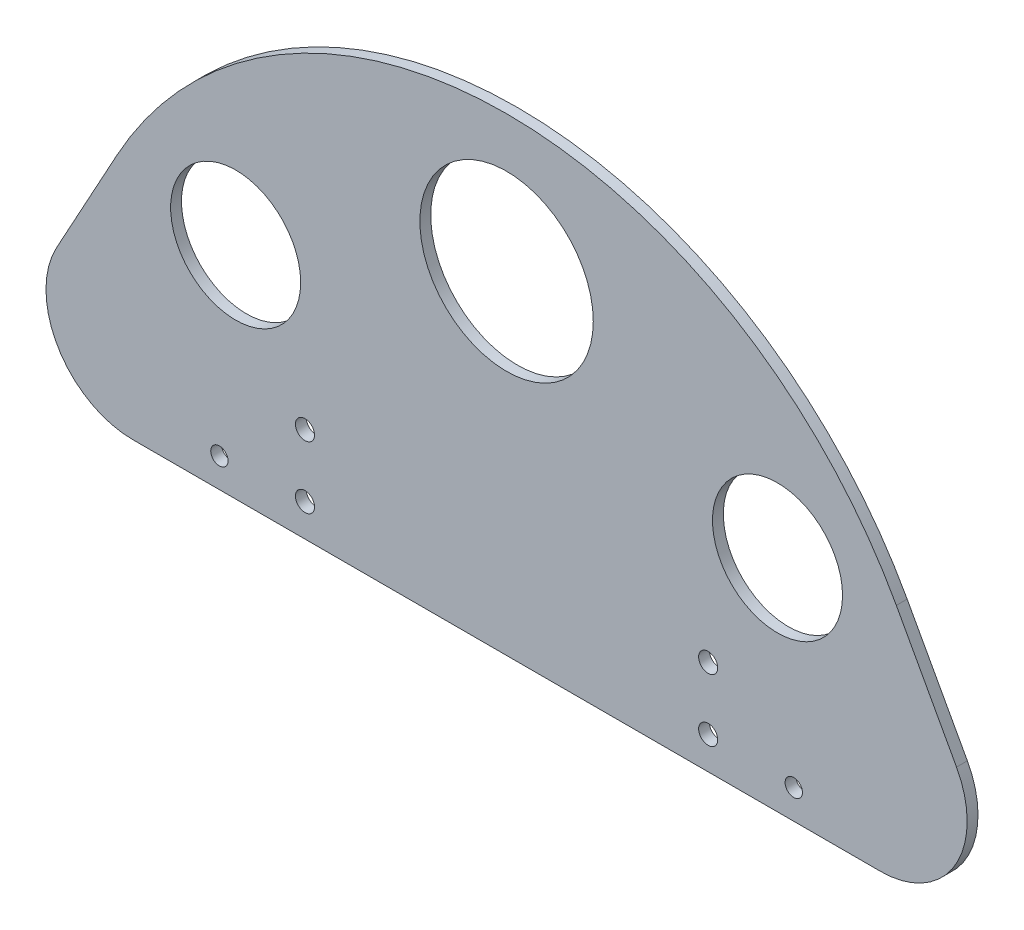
SolidWorks part; units mm, degrees
ref_plane "Front Plane" through (0, 0, 0) normal (0, 0, 1) x (1, 0, 0)
ref_plane "Top Plane" through (0, 0, 0) normal (0, 1, 0) x (1, 0, 0)
ref_plane "Right Plane" through (0, 0, 0) normal (1, 0, 0) x (0, 0, -1)
sketch "Sketch1" plane through (0, 0, 0) normal (0, 0, 1) x (1, 0, 0)
  line L0 (-219.075, -131.4329) -> (219.075, -131.4329)
  line L1 (263.6346, -56.2386) -> (228.3679, 8.1809)
  line L2 (-263.6346, -56.2386) -> (-228.3679, 8.1809)
  circle A0 centre (-158.75, -2.54) radius 38.1
  circle A1 centre (0, 63.5) radius 50.8
  arc A2 (219.075, -131.4329) -> (263.6346, -56.2386) centre (219.075, -80.6329) ccw
  circle A3 centre (158.75, -2.54) radius 38.1
  arc A4 (228.3679, 8.1809) -> (-228.3679, 8.1809) centre (0, -116.84) ccw
  arc A5 (-263.6346, -56.2386) -> (-219.075, -131.4329) centre (-219.075, -80.6329) ccw
  circle A6 centre (-118.11, -75.8831) radius 5.588
  circle A7 centre (-118.11, -112.3829) radius 5.588
  circle A8 centre (118.11, -75.8831) radius 5.588
  circle A9 centre (118.11, -112.3829) radius 5.588
  point P14 (304.8, -131.4329)
  point P15 (304.8, -131.4329)
  point P16 (304.8, -131.4329)
  point P18 (-304.8, -131.4329)
  point P24 (-304.8, -131.4329)
  dimension "D4" = 76.2
  dimension "D7" = 101.6
  dimension "D11" = 438.15
  dimension "D13" = 219.075
  dimension "D9" = 260.35
  dimension "D10" = 11.176
  dimension "D16" = 219.075
  dimension "D18" = 19.05
  dimension "D3" = 50.8
  dimension "D17" = 116.84
  dimension "D19" = 11.176
  dimension "D1" = 609.6
  dimension "D2" = 304.8
  dimension "D5" = 158.75
  dimension "D6" = 2.54
  dimension "D8" = 63.5
  dimension "D12" = 158.75
  dimension "D14" = 36.4998
  dimension "D15" = 118.11
  dimension "D20" = 36.4998
  dimension "D21" = 19.05
  dimension "D22" = 118.11
extrude "Extrude1" add sketch "Sketch1" along normal mid plane 6.35
sketch "Sketch2" plane through (0, 0, 3.175) normal (0, 0, 1) x (1, 0, 0)
  circle A0 centre (-114.3, 31.75) radius 31.75
  circle A1 centre (114.3, 31.75) radius 31.75
  circle A2 centre (-50.8, -66.675) radius 31.75
  circle A3 centre (50.8, -66.675) radius 31.75
  dimension "D1" = 63.5
  dimension "D2" = 31.75
  dimension "D3" = 114.3
  dimension "D4" = 50.8
  dimension "D5" = 50.8
  dimension "D6" = 66.675
extrude "Cut-Extrude1" [suppressed] cut sketch "Sketch2" against normal through all
sketch "Sketch3" plane through (0, 0, 3.175) normal (0, 0, 1) x (1, 0, 0)
  circle A0 centre (168.275, -114.3) radius 5.08
  dimension "D1" = 10.16
  dimension "D2" = 168.275
  dimension "D3" = 177.8
extrude "Cut-Extrude2" cut sketch "Sketch3" against normal through all
mirror "Mirror1" about plane through (0, 0, 0) normal (1, 0, 0) of "Cut-Extrude2"
